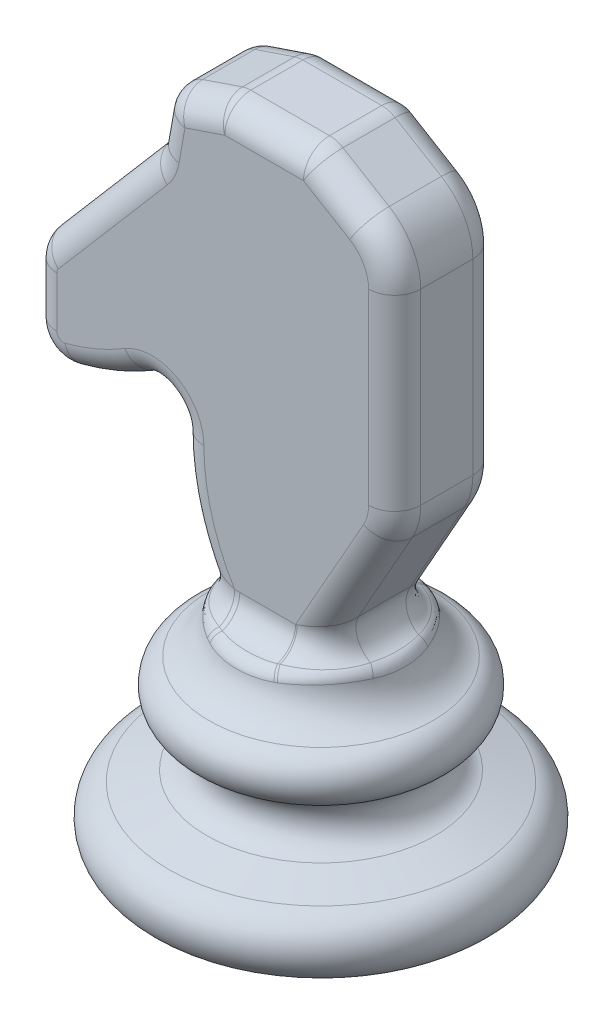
SolidWorks part; units mm, degrees
ref_plane "Front" through (0, 0, 0) normal (0, 0, 1) x (1, 0, 0)
ref_plane "Top" through (0, 0, 0) normal (0, 1, 0) x (1, 0, 0)
ref_plane "Right" through (0, 0, 0) normal (1, 0, 0) x (0, 0, -1)
sketch "Sketch1" plane through (0, 0, 0) normal (0, 0, 1) x (1, 0, 0)
  line L0 (0, 0) -> (0, 72.0534) construction
  line L1 (0, 0) -> (13.97, 0)
  line L2 (14.8003, 5.9807) -> (11.1344, 7.0186)
  line L6 (0, 20.574) -> (0, 0)
  line L9 (8.128, 20.574) -> (0, 20.574)
  arc A0 (13.97, 0) -> (14.8003, 5.9807) centre (13.97, 3.048) ccw
  arc A1 (11.1344, 7.0186) -> (10.941, 11.8433) centre (11.8263, 9.4625) cw
  arc A2 (10.941, 11.8433) -> (10.914, 16.6146) centre (10.0557, 14.224) ccw
  arc A3 (10.914, 16.6146) -> (8.128, 20.574) centre (12.3359, 20.575) cw
  dimension "D2" = 3.048
  dimension "D4" = 2.54
  dimension "D5" = 20.574
  dimension "D12" = 14.224
  dimension "D14" = 13.97
  dimension "D15" = 11.8263
  dimension "D16" = 4.2079
  dimension "D3" = 3.81
  dimension "D6" = 8.128
revolve "Base-Revolve" add sketch "Sketch1" angle 360 about L0
sketch "Sketch2" plane through (0, 0, 0) normal (0, 0, 1) x (1, 0, 0)
  line L1 (-17.018, 0) -> (17.018, 0)
  line L2 (-17.018, 0) -> (-17.018, 63.5)
  line L3 (-17.018, 63.5) -> (17.018, 63.5)
  line L4 (17.018, 0) -> (17.018, 63.5)
  arc A0 (-14.8003, 5.9807) -> (-13.97, 0) centre (-13.97, 3.048) ccw construction
  dimension "D1" = 63.5
sketch "Sketch3" plane through (0, 0, 0) normal (0, 0, 1) x (1, 0, 0)
  line L0 (0, 0) -> (0, 63.5) construction
  line L1 (-17.018, 63.5) -> (17.018, 63.5) construction
  line L2 (4.0802, 63.5) -> (-4.7197, 63.5)
  line L3 (-4.7197, 63.5) -> (-10.4137, 61.575)
  line L4 (-10.4137, 61.575) -> (-11.3832, 56.1342)
  line L5 (-11.3832, 56.1342) -> (-22.4401, 43.2232)
  line L6 (-23.2036, 41.158) -> (-23.2036, 36.2349)
  line L9 (8.128, 20.574) -> (-8.128, 20.574) construction
  line L10 (4.0802, 63.5) -> (9.1858, 60.4241)
  line L11 (12.2589, 54.9849) -> (12.2589, 36.7395)
  line L12 (11.4395, 33.6195) -> (4.0802, 20.574)
  line L13 (-4.7197, 20.574) -> (4.0802, 20.574)
  arc A0 (11.4395, 33.6195) -> (12.2589, 36.7395) centre (5.9089, 36.7395) ccw
  arc A1 (12.2589, 54.9849) -> (9.1858, 60.4241) centre (5.9089, 54.9849) ccw
  arc A2 (-19.2146, 33.166) -> (-23.2036, 36.2349) centre (-20.0286, 36.2349) cw
  arc A3 (-23.2036, 41.158) -> (-22.4401, 43.2232) centre (-20.0286, 41.158) cw
  arc A4 (-4.7197, 20.574) -> (-8.1923, 39.4229) centre (14.3074, 33.8238) cw
  arc A5 (-8.1923, 39.4229) -> (-19.2146, 33.166) centre (-25.6057, 57.2617) cw
  dimension "D1" = 6.35
  dimension "D2" = 3.175
extrude "Boss-Extrude1" add sketch "Sketch3" along normal mid plane 10.16
fillet "Fillet1" radius 2.54 5 edges at (4.0802, 63.5, 0) (-4.7197, 63.5, 0) (-10.4137, 61.575, 0) (-11.3832, 56.1342, 0) (-8.1923, 39.4229, 0)
fillet "Fillet3" radius 2.54 38 edges at (6.9353, 61.7799, -5.08) (-23.0066, 42.2589, -5.08) (-23.2036, 38.6964, -5.08) (-21.9646, 33.7184, -5.08) (-15.8748, 34.3105, -5.08) (7.7599, 27.0967, -5.08) (12.0506, 35.1266, -5.08) (12.2589, 45.8622, -5.08) (11.4375, 58.1086, -5.08) (6.9353, 61.7799, 5.08) (-23.0066, 42.2589, 5.08) (-23.2036, 38.6964, 5.08) (-21.9646, 33.7184, 5.08) (-15.8748, 34.3105, 5.08) (7.7599, 27.0967, 5.08) (12.0506, 35.1266, 5.08) (12.2589, 45.8622, 5.08) (11.4375, 58.1086, 5.08) (-7.8031, 26.8443, -5.08) (-7.8031, 26.8443, 5.08) (-17.1366, 49.416, -5.08) (-17.1366, 49.416, 5.08) (-10.9695, 58.4554, -5.08) (-10.9695, 58.4554, 5.08) (-7.0528, 62.7112, -5.08) (-0.4639, 63.5, -5.08) (4.0544, 63.4072, -5.08) (-4.7141, 63.4663, -5.08) (-10.102, 61.3067, -5.08) (-7.0528, 62.7112, 5.08) (-0.4639, 63.5, 5.08) (4.0544, 63.4072, 5.08) (-4.7141, 63.4663, 5.08) (-10.102, 61.3067, 5.08) (-10.1731, 35.954, -5.08) (-10.1731, 35.954, 5.08) (-11.4668, 56.1738, -5.08) (-11.4668, 56.1738, 5.08)
fillet "Fillet4" radius 2.54 8 edges at (-4.7197, 20.574, 0) (3.226, 20.574, 4.3361) (3.226, 20.574, -4.3361) (-3.7368, 20.574, 4.39) (-3.6613, 20.574, -4.4453) (-0.1811, 20.574, 5.08) (4.0802, 20.574, 0) (-0.1811, 20.574, -5.08)
fillet "Fillet7" radius 1.27 14 edges at (8.128, 20.574, 0) (5.925, 20.574, 5.564) (0.0064, 20.574, 8.128) (-3.0466, 20.574, 7.5354) (-6.1258, 20.574, 5.3422) (-8.128, 20.574, 0) (-6.1258, 20.574, -5.3422) (-3.0466, 20.574, -7.5354) (0.0064, 20.574, -8.128) (-0.1158, 20.574, 7.62) (2.7186, 20.574, 7.6189) (2.7186, 20.574, -7.6189) (-0.1158, 20.574, -7.62) (5.925, 20.574, -5.564)
